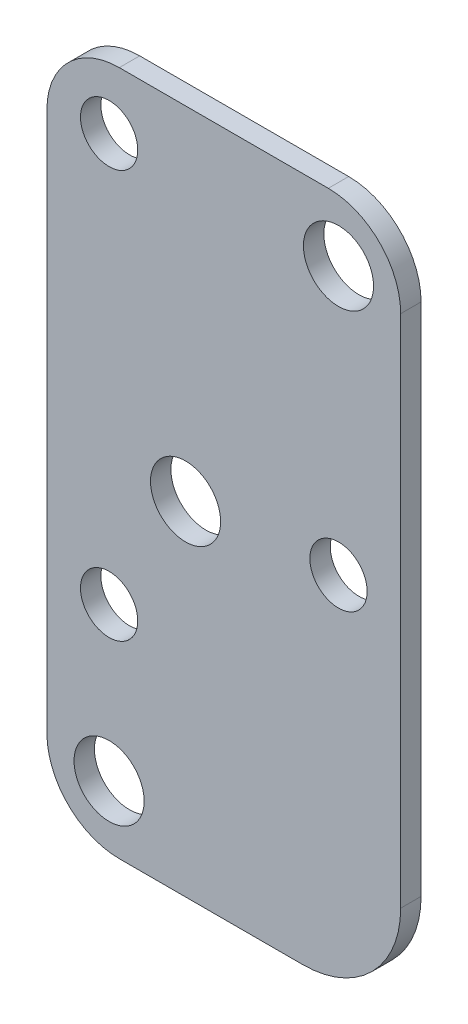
SolidWorks part; units mm, degrees
ref_plane "Front" through (0, 0, 0) normal (0, 0, 1) x (1, 0, 0)
ref_plane "Top" through (0, 0, 0) normal (0, 1, 0) x (1, 0, 0)
ref_plane "Right" through (0, 0, 0) normal (1, 0, 0) x (0, 0, -1)
ref_plane "Plane1"
sketch "Sketch1" plane through (0, 0, 82.1182) normal (0, 0, -1) x (-1, 0, 0)
  line L4 (147.955, 87.3252) -> (121.92, 87.3252)
  line L5 (147.955, 87.3252) -> (121.92, 87.3252)
  line L6 (112.395, 77.8002) -> (112.395, 13.6652)
  line L7 (112.395, 77.8002) -> (112.395, 13.6652)
  line L34 (125.095, 0.9652) -> (147.955, 0.9652)
  line L44 (125.095, 0.9652) -> (147.955, 0.9652)
  line L45 (157.48, 10.4902) -> (157.48, 77.8002)
  line L46 (157.48, 10.4902) -> (157.48, 77.8002)
  arc A4 (121.92, 87.3252) -> (112.395, 77.8002) centre (121.92, 77.8002) ccw
  arc A5 (121.92, 87.3252) -> (112.395, 77.8002) centre (121.92, 77.8002) ccw
  arc A6 (112.395, 13.6652) -> (125.095, 0.9652) centre (125.095, 13.6652) ccw
  arc A7 (112.395, 13.6652) -> (125.095, 0.9652) centre (125.095, 13.6652) ccw
  arc A35 (147.955, 0.9652) -> (157.48, 10.4902) centre (147.955, 10.4902) ccw
  arc A45 (147.955, 0.9652) -> (157.48, 10.4902) centre (147.955, 10.4902) ccw
  arc A46 (157.48, 77.8002) -> (147.955, 87.3252) centre (147.955, 77.8002) ccw
  arc A47 (157.48, 77.8002) -> (147.955, 87.3252) centre (147.955, 77.8002) ccw
sketch "Sketch2" plane through (0, 0, 82.1182) normal (0, 0, -1) x (-1, 0, 0)
  line L4 (147.955, 86.8172) -> (121.92, 86.8172)
  line L5 (147.955, 86.8172) -> (121.92, 86.8172)
  line L6 (112.903, 77.8002) -> (112.903, 13.6652)
  line L7 (112.903, 77.8002) -> (112.903, 13.6652)
  line L12 (125.095, 1.4732) -> (147.955, 1.4732)
  line L13 (125.095, 1.4732) -> (147.955, 1.4732)
  line L15 (156.972, 10.4902) -> (156.972, 77.8002)
  line L16 (156.972, 10.4902) -> (156.972, 77.8002)
  arc A4 (121.92, 86.8172) -> (112.903, 77.8002) centre (121.92, 77.8002) ccw
  arc A5 (121.92, 86.8172) -> (112.903, 77.8002) centre (121.92, 77.8002) ccw
  arc A6 (112.903, 13.6652) -> (125.095, 1.4732) centre (125.095, 13.6652) ccw
  arc A7 (112.903, 13.6652) -> (125.095, 1.4732) centre (125.095, 13.6652) ccw
  arc A12 (147.955, 1.4732) -> (156.972, 10.4902) centre (147.955, 10.4902) ccw
  arc A14 (147.955, 1.4732) -> (156.972, 10.4902) centre (147.955, 10.4902) ccw
  arc A16 (156.972, 77.8002) -> (147.955, 86.8172) centre (147.955, 77.8002) ccw
  arc A17 (156.972, 77.8002) -> (147.955, 86.8172) centre (147.955, 77.8002) ccw
extrude "Boss-Extrude1" add sketch "Sketch2" against normal blind 2.54 flip side to cut
hole_wizard "Hole12" positions "Point_Sketch2" profile "Profil_Sketch2" hole size "Ø0.15" standard "ISO"
sketch "Point_Sketch2" plane through (-130.0193, 64.0173, 84.6582) normal (0, 0, -1) x (1, 0, 0)
  point P0 (-19.2057, 35.7471)
  point P2 (9.3693, 18.2846)
  point P4 (-19.2057, -15.0529)
sketch "Profil_Sketch2" plane through (-149.225, 28.2702, 84.6582) normal (1, 0, 0) x (0, -1, 0)
  line L0 (0, 0) -> (0, 2.54)
  line L1 (0, 2.54) -> (3.5687, 2.54)
  line L2 (3.5687, 2.54) -> (3.5687, 0)
  line L5 (3.5687, 0) -> (0, 0)
  line L11 (0, -6.35) -> (0, 107.95) construction
  dimension "Diameter" = 7.1374
  dimension "Thru Hole Depth" = 2.54
other "usin_DL090_.25-20x.625-SHCS<3>"
hole_wizard "Hole1" positions "Point_Sketch" profile "Profil_Sketch" hole size "Ø0.15" standard "ISO"
sketch "Point_Sketch" plane through (-116.9957, 89.6713, 82.1182) normal (0, 0, 1) x (-1, 0, 0)
  point P0 (3.6543, 10.6011)
  point P2 (22.7043, 45.5261)
  point P4 (32.2293, 80.4511)
sketch "Profil_Sketch" plane through (-120.65, 79.0702, 82.1182) normal (1, 0, 0) x (0, 1, 0)
  line L0 (0, 0) -> (0, 2.54)
  line L1 (0, 2.54) -> (4.3688, 2.54)
  line L2 (4.3688, 2.54) -> (4.3688, 0)
  line L5 (4.3688, 0) -> (0, 0)
  line L11 (0, -6.35) -> (0, 107.95) construction
  dimension "Diameter" = 8.7376
  dimension "Thru Hole Depth" = 2.54
other "usin_DL090_.3125-18x2-SHCS<4>"
